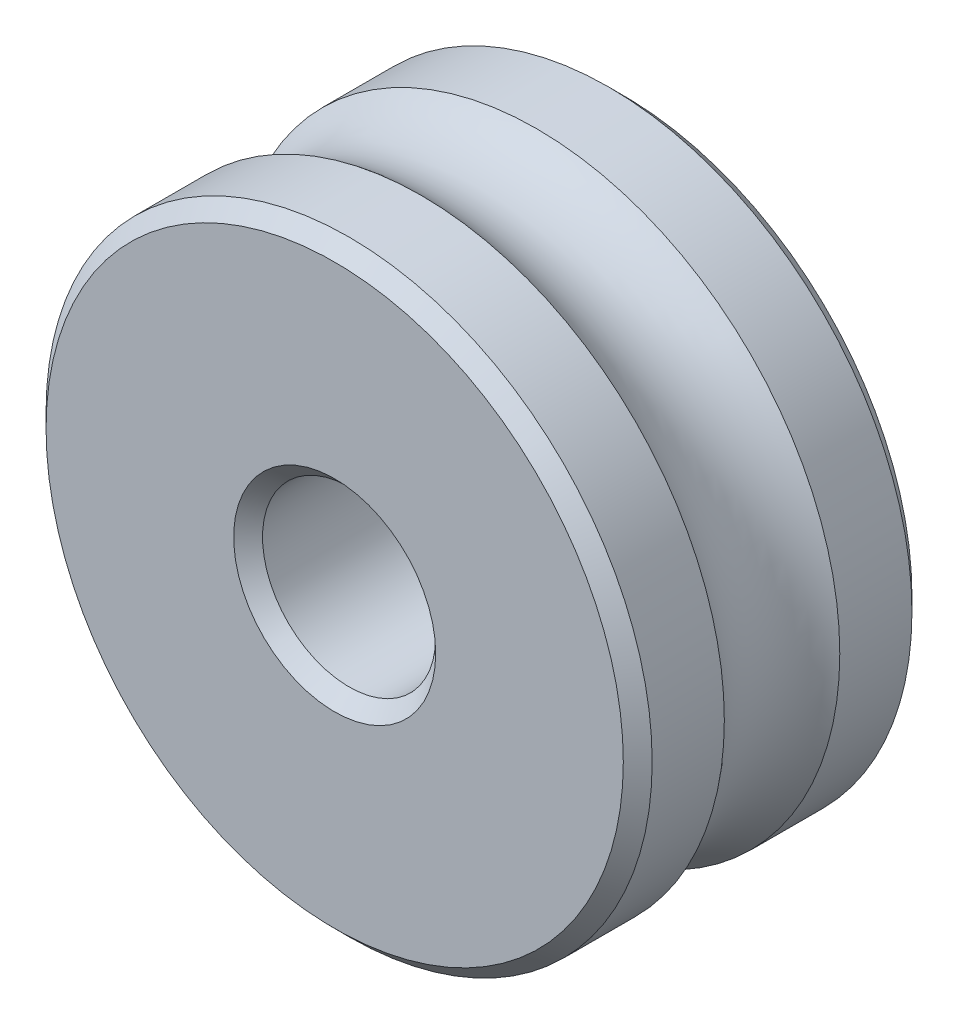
SolidWorks part; units mm, degrees
ref_plane "Płaszczyzna przednia" through (0, 0, 0) normal (0, 0, 1) x (1, 0, 0)
ref_plane "Płaszczyzna górna" through (0, 0, 0) normal (0, 1, 0) x (1, 0, 0)
ref_plane "Płaszczyzna prawa" through (0, 0, 0) normal (1, 0, 0) x (0, 0, -1)
sketch "Sketch1" plane through (0, 0, 0) normal (0, 0, 1) x (1, 0, 0)
  circle A0 centre (0, 0) radius 21
  circle A1 centre (0, 0) radius 6
  dimension "D1" = 42
  dimension "D2" = 12
extrude "Boss-Extrude1" add sketch "Sketch1" along normal mid plane 20
sketch "Sketch4" plane through (0, 0, 0) normal (1, 0, 0) x (0, 0, -1)
  line L0 (0, 0) -> (10, 0) construction
  line L1 (10, -21) -> (10, 21) construction
  line L2 (0, 21) -> (0, 25.4721) construction
  line L3 (10, 21) -> (-10, 21) construction
  line L4 (4, 21) -> (-4, 21)
  arc A0 (-4, 21) -> (4, 21) centre (0, 25.4721) ccw
  dimension "D1" = 12
  dimension "D2" = 6
revolve "Cut-Revolve1" cut sketch "Sketch4" angle 360 about L0
sketch "Sketch5" plane through (0, 0, 10) normal (0, 0, 1) x (1, 0, 0)
chamfer "Chamfer1" distance 1 angle 45 4 edges at (6, 0, 10) (21, 0, 10) (6, 0, -10) (21, 0, -10)
